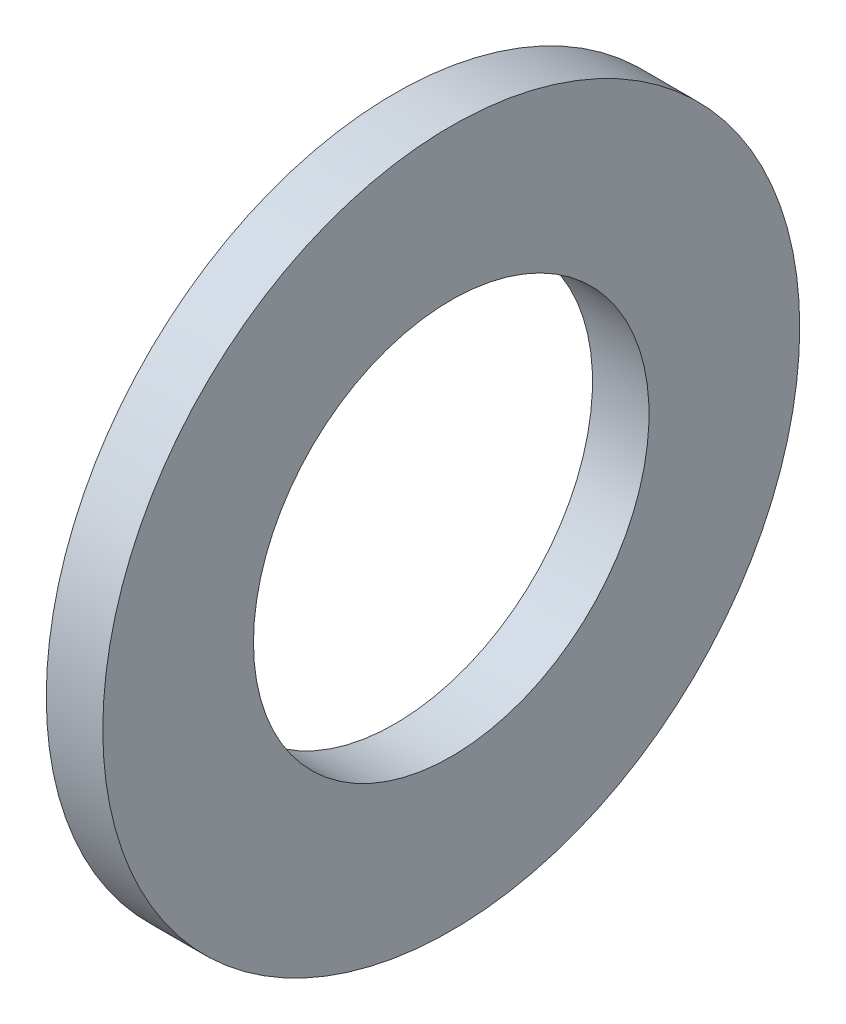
SolidWorks part; units mm, degrees
ref_plane "Plane1" through (0, 0, 0) normal (0, 0, 1) x (1, 0, 0)
ref_plane "Plane2" through (0, 0, 0) normal (0, 1, 0) x (1, 0, 0)
ref_plane "Plane3" through (0, 0, 0) normal (1, 0, 0) x (0, 0, -1)
sketch "Sketch1" plane through (0, 0, 0) normal (0, 0, 1) x (1, 0, 0)
  line L0 (-34.925, 0) -> (9.525, 0) construction
  line L1 (0, 10.5) -> (0, 18.5)
  line L2 (0, 18.5) -> (-3, 18.5)
  line L3 (-3, 18.5) -> (-3, 10.5)
  line L4 (-3, 10.5) -> (0, 10.5)
revolve "Base-Revolve" add sketch "Sketch1" angle 360 about L0
chamfer "ODChamfer" [suppressed] distance 0.75 angle 45
equation "\"D1@ODChamfer\" =  \"Thickness@Sketch1\" * 0.25"
